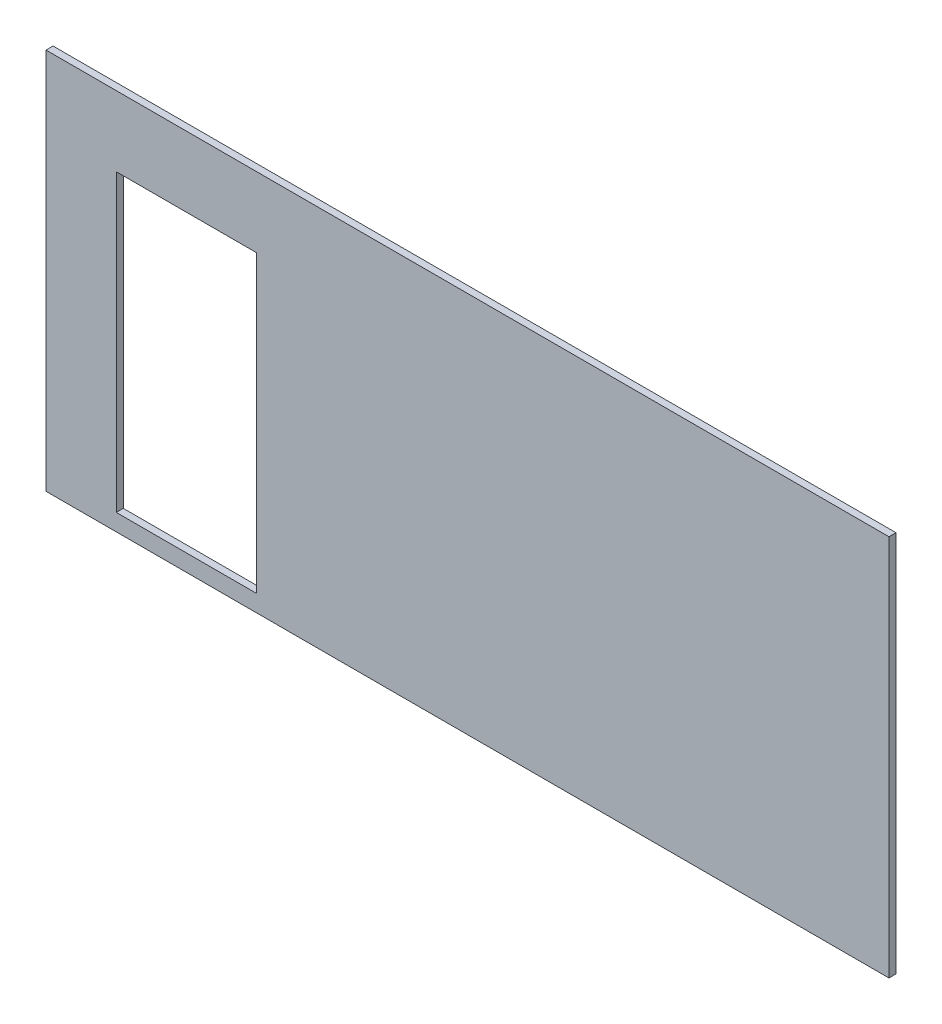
SolidWorks part; units mm, degrees
ref_plane "Face" through (0, 0, 0) normal (0, 0, 1) x (1, 0, 0)
ref_plane "Dessus" through (0, 0, 0) normal (0, 1, 0) x (1, 0, 0)
ref_plane "Droite" through (0, 0, 0) normal (1, 0, 0) x (0, 0, -1)
sketch "Esquisse1" plane through (0, 0, 0) normal (0, 0, 1) x (1, 0, 0)
  line L0 (571.4894, 0) -> (571.4894, 272)
  line L1 (-28.5106, 0) -> (571.4894, 0)
  line L2 (-28.5106, 0) -> (-28.5106, 272)
  line L3 (571.4894, 272) -> (-28.5106, 272)
  line L4 (-28.5106, 272) -> (-28.4655, 271.5731)
  line L5 (21.4894, 12) -> (121.4894, 12)
  line L6 (21.4894, 12) -> (21.4894, 222)
  line L7 (21.4894, 222) -> (121.4894, 222)
  line L8 (121.4894, 12) -> (121.4894, 222)
  dimension "D1" = 50
  dimension "D2" = 600
  dimension "D3" = 100
  dimension "D4" = 210
  dimension "D5" = 222
extrude "Extrusion1" add sketch "Esquisse1" along normal blind 5
